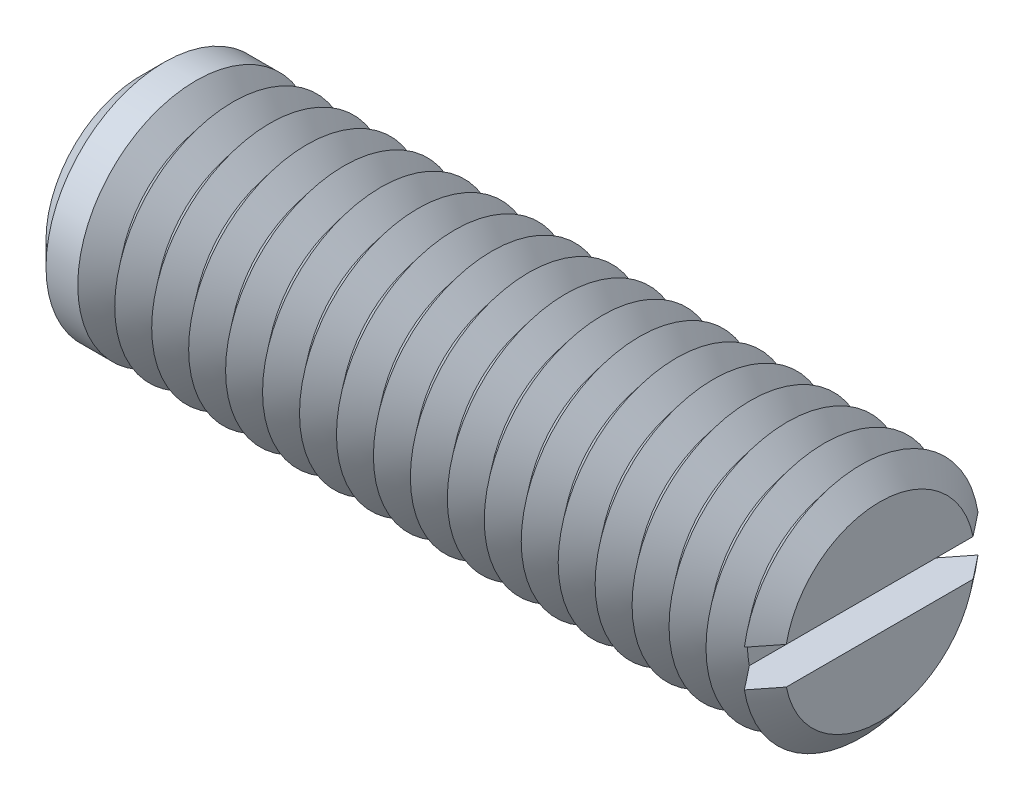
SolidWorks part; units mm, degrees
ref_plane "Front Plane" through (0, 0, 0) normal (0, 0, 1) x (1, 0, 0)
ref_plane "Top Plane" through (0, 0, 0) normal (0, 1, 0) x (1, 0, 0)
ref_plane "Right Plane" through (0, 0, 0) normal (1, 0, 0) x (0, 0, -1)
sketch "Sketch1" plane through (0, 0, 0) normal (1, 0, 0) x (0, 0, -1)
  circle A0 centre (0, 0) radius 4
  dimension "D1" = 8
extrude "Extrude1" add sketch "Sketch1" along normal mid plane 25
sketch "Sketch2" plane through (0, 0, 0) normal (0, 0, 1) x (1, 0, 0)
  line L0 (12.5, 0.625) -> (11.25, 0.625)
  line L1 (12.5, -4) -> (12.5, 4) construction
  line L2 (11.25, 0.625) -> (11.25, -0.625)
  line L3 (0, 0) -> (50000, 0) construction
  line L4 (12.5, -0.625) -> (11.25, -0.625)
  line L5 (12.5, -0.625) -> (12.5, 0.625)
  point P9 (11.25, 0)
  dimension "D1" = 1.25
extrude "Extrude2" cut sketch "Sketch2" against normal mid plane 12
chamfer "Chamfer1" distance 0.8 angle 45 1 edges at (-12.5, 0, -4)
sketch "Sketch3" plane through (0, 0, 0) normal (0, 0, 1) x (1, 0, 0)
  line L0 (0, 0) -> (30.9602, 0) construction
  line L1 (11.875, -4) -> (13.125, -4)
  line L2 (-11.7, -4) -> (12.5, -4) construction
  line L3 (13.125, -4) -> (12.5, -3.2194)
  line L4 (12.5, -4) -> (12.5, -0.625) construction
  line L5 (12.5, -3.2194) -> (11.875, -4)
  dimension "D1" = 1.25
  dimension "D2" = 1
revolve "Cut-Revolve1" cut sketch "Sketch3" angle 360 about L0
pattern_linear "LPattern1" count 19 spacing 1.25 along (-1, 0, 0) of "Cut-Revolve1"
equation "\"D2@Sketch3\" = \"D1@Sketch3\"*0.8"
